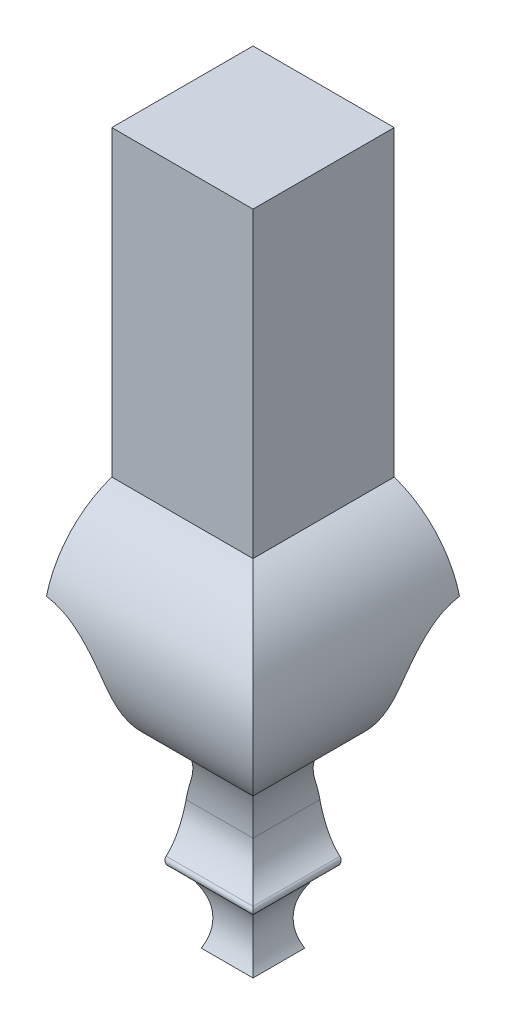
SolidWorks part; units mm, degrees
ref_plane "Alzado" through (0, 0, 0) normal (0, 0, 1) x (1, 0, 0)
ref_plane "Planta" through (0, 0, 0) normal (0, 1, 0) x (1, 0, 0)
ref_plane "Vista lateral" through (0, 0, 0) normal (1, 0, 0) x (0, 0, -1)
sketch "Croquis1" plane through (0, 0, 0) normal (0, 1, 0) x (1, 0, 0)
  line L0 (60, 60) -> (-60, -60) construction
  line L1 (-60, 60) -> (60, 60)
  line L2 (-60, 60) -> (-60, -60)
  line L3 (-60, -60) -> (60, -60)
  line L4 (60, 60) -> (60, -60)
extrude "Saliente-Extruir1" add sketch "Croquis1" along normal mid plane 350
ref_plane "Plano1" through (0, 0, 0) normal (0.7071, 0, -0.7071) x (-0.7071, 0, -0.7071)
sketch "Croquis2" plane through (0, 0, 0) normal (0, 0, 1) x (1, 0, 0)
  line L0 (-50, 70) -> (20, 70) construction
  line L1 (20, 70) -> (20, 20)
  line L2 (-60, 175) -> (60, 175) construction
  line L3 (-50, 70) -> (-50, -15)
  line L4 (-60, 175) -> (-60, -175) construction
  line L5 (-15.645, -170) -> (10, -170)
  line L6 (-50, 70) -> (-50, 170)
  line L7 (20, 70) -> (20, 170)
  line L8 (20, 170) -> (-50, 170)
  line L10 (-60, -175) -> (60, -175)
  line L11 (60, -175) -> (60, 175)
  line L12 (60, 175) -> (-60, 175)
  line L13 (-60, 175) -> (-60, -175)
  line L14 (-60, -175) -> (60, -175)
  line L15 (60, -175) -> (60, 175)
  line L16 (60, 175) -> (-60, 175)
  line L17 (-60, 175) -> (-60, -175)
  arc A0 (20, 20) -> (30, -70) centre (3.9165, -27.3426) cw
  arc A1 (30, -70) -> (5, -115) centre (57.2668, -114.5927) ccw
  arc A2 (5, -115) -> (20, -135) centre (26.0521, -114.8359) ccw
  arc A3 (-50, -15) -> (-20, -40) centre (-53.5957, -49.8148) cw
  arc A4 (-20, -40) -> (-25, -105) centre (-108.5807, -65.8784) cw
  arc A5 (-25, -105) -> (-20, -146.9536) centre (11.2278, -121.9571) ccw
  arc A6 (20, -135) -> (10, -170) centre (26.8837, -155.8953) ccw
  arc A7 (-20, -146.9536) -> (-15.645, -170) centre (-39.5174, -162.5764) cw
  dimension "D12" = 50
  dimension "D14" = 22
  dimension "D19" = 35
  dimension "D21" = 40
  dimension "D23" = 25
  dimension "D1" = 105
  dimension "D2" = 10
  dimension "D3" = 70
  dimension "D4" = 240
  dimension "D5" = 140
  dimension "D6" = 205
  dimension "D7" = 80
  dimension "D8" = 70
  dimension "D9" = 55
  dimension "D10" = 185
  dimension "D11" = 60
  dimension "D13" = 50
  dimension "D15" = 30
  dimension "D16" = 110
  dimension "D17" = 175
  dimension "D18" = 25
  dimension "D20" = 85
  dimension "D22" = 30
  dimension "D25" = 100
  dimension "D24" = 0
extrude "Sierra Cita - perfil" cut sketch "Croquis2" against normal through all and the other way through all
mirror "Simetría1" about plane through (0, 0, 0) normal (0.7071, 0, -0.7071) of "Sierra Cita - perfil"
fillet "Redondeo1" radius 2 2 edges at (20, -135, -3.293) (-3.293, -135, 20)
sketch "Croquis3" plane through (-50, 0, 0) normal (-1, 0, 0) x (0, 0, 1)
  line L0 (-5, 132.5) -> (-5, 57.5) construction
  line L1 (3, 132.5) -> (3, 57.5)
  line L2 (-13, 132.5) -> (-13, 57.5)
  line L3 (-50, 170) -> (-50, -15) construction
  line L4 (-5, 95) -> (20, 95) construction
  line L6 (20, 20) -> (20, 170) construction
  arc A0 (3, 132.5) -> (-13, 132.5) centre (-5, 132.5) ccw
  arc A1 (-13, 57.5) -> (3, 57.5) centre (-5, 57.5) ccw
  point P2 (-5, 95)
  dimension "D3" = 8
  dimension "D1" = 45
  dimension "D4" = 75
extrude "Escopleado" cut sketch "Croquis3" against normal blind 27
mirror "Simetría2" about plane through (0, 0, 0) normal (0.7071, 0, -0.7071) of "Escopleado"
ref_plane "Plano medio Escopleado" through (0, 95, 0) normal (0, -1, 0) x (-1, 0, 0)
